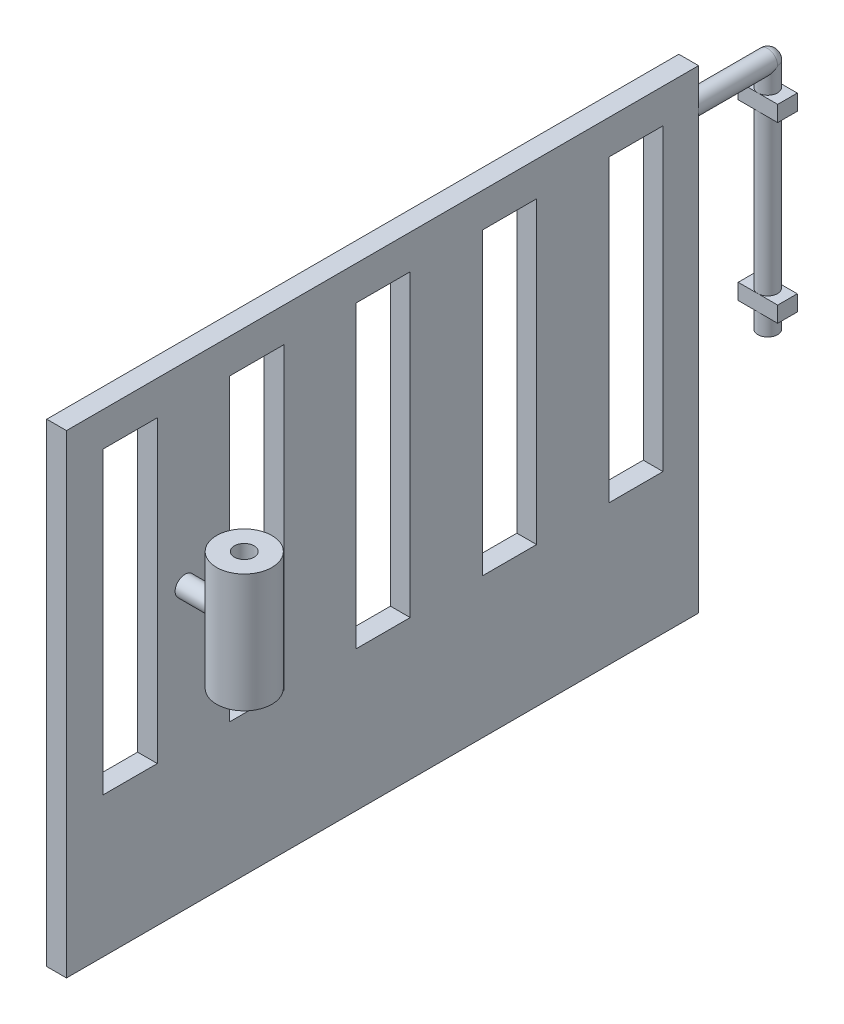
SolidWorks part; units mm, degrees
ref_plane "Face" through (0, 0, 0) normal (0, 0, 1) x (1, 0, 0)
ref_plane "Dessus" through (0, 0, 0) normal (0, 1, 0) x (1, 0, 0)
ref_plane "Droite" through (0, 0, 0) normal (1, 0, 0) x (0, 0, -1)
sketch "Esquisse1" plane through (0, 0, 0) normal (0, 0, 1) x (1, 0, 0)
  line L1 (0, 0) -> (5, 0)
  line L2 (0, 0) -> (0, 120)
  line L3 (0, 120) -> (5, 120)
  line L4 (5, 0) -> (5, 120)
  dimension "D1" = 5
  dimension "D2" = 120
extrude "Base-Extrusion" add sketch "Esquisse1" along normal blind 160
sketch "Esquisse2" plane through (0, 0, 0) normal (0, 0, -1) x (-1, 0, 0)
  line L0 (0, 120) -> (0, 0) construction
  circle A0 centre (-2.5, 110) radius 2.5
  dimension "D1" = 5
  dimension "D2" = 110
  dimension "D3" = 2.5
extrude "Boss.-Extru.1" add sketch "Esquisse2" along normal blind 20
sketch "Esquisse3" plane through (0, 0, -20) normal (0, 0, -1) x (-1, 0, 0)
  line L0 (-15.626, 110) -> (23.1147, 110) construction
  line L1 (-5, 110) -> (0, 110)
  circle A1 centre (-2.5, 110) radius 2.5
  arc A2 (0, 110) -> (-5, 110) centre (-2.5, 110) ccw
  dimension "D1" = 0
revolve "Boss.-Révol.1" add sketch "Esquisse3" angle 90 about L0
sketch "Esquisse4" plane through (0, 110, 0) normal (0, -1, 0) x (1, 0, 0)
  line L0 (2.5, -20) -> (2.5, 0) construction
  circle A0 centre (2.5, -20) radius 2.4792
extrude "Boss.-Extru.2" add sketch "Esquisse4" along normal blind 10
sketch "Esquisse5" plane through (0, 100, 0) normal (0, -1, 0) x (1, 0, 0)
  line L1 (7.5, -17.5208) -> (-2.5, -17.5208)
  line L2 (7.5, -17.5208) -> (7.5, -22.4792)
  line L3 (7.5, -22.4792) -> (-2.5, -22.4792)
  line L4 (-2.5, -17.5208) -> (-2.5, -22.4792)
  circle A0 centre (2.5, -20) radius 2.4792 construction
  dimension "D2" = 5
  dimension "D1" = 5
extrude "Boss.-Extru.3" add sketch "Esquisse5" against normal blind 4
sketch "Esquisse7" plane through (0, 100, 0) normal (0, -1, 0) x (1, 0, 0)
  arc A0 (2.5, -17.5208) -> (2.5, -22.4792) centre (2.5, -20) ccw construction
  arc A1 (2.5, -17.5208) -> (2.5, -22.4792) centre (2.5, -20) ccw
  arc A2 (2.5, -22.4792) -> (2.5, -17.5208) centre (2.5, -20) ccw construction
  arc A3 (2.5, -22.4792) -> (2.5, -17.5208) centre (2.5, -20) ccw
extrude "Boss.-Extru.4" add sketch "Esquisse7" along normal blind 40
sketch "Esquisse8" plane through (0, 60, 0) normal (0, -1, 0) x (1, 0, 0)
  line L1 (7.5, -17.5208) -> (-2.5, -17.5208)
  line L2 (7.5, -17.5208) -> (7.5, -22.4792)
  line L3 (7.5, -22.4792) -> (-2.5, -22.4792)
  line L4 (-2.5, -17.5208) -> (-2.5, -22.4792)
extrude "Boss.-Extru.5" add sketch "Esquisse8" along normal blind 4
sketch "Esquisse9" plane through (0, 56, 0) normal (0, -1, 0) x (1, 0, 0)
  arc A0 (2.5, -22.4792) -> (2.5, -17.5208) centre (2.5, -20) ccw construction
  arc A1 (2.5, -22.4792) -> (2.5, -17.5208) centre (2.5, -20) ccw
  arc A2 (2.5, -17.5208) -> (2.5, -22.4792) centre (2.5, -20) ccw construction
  arc A3 (2.5, -17.5208) -> (2.5, -22.4792) centre (2.5, -20) ccw
extrude "Boss.-Extru.6" add sketch "Esquisse9" along normal blind 5
sketch "Esquisse10" plane through (5, 0, 0) normal (1, 0, 0) x (0, 0, -1)
  line L0 (-160, 0) -> (-160, 120) construction
  line L1 (-160, 0) -> (0, 0) construction
  circle A0 centre (-130, 71) radius 2.5
  dimension "D1" = 5
  dimension "D2" = 30
  dimension "D3" = 71
extrude "Boss.-Extru.7" add sketch "Esquisse10" along normal blind 15
ref_plane "Plan1" through (0, 71, 0) normal (0, 1, 0) x (-1, 0, 0)
sketch "Esquisse11" plane through (0, 71, 0) normal (0, 1, 0) x (-1, 0, 0)
  line L0 (-20, 130) -> (-5, 130) construction
  line L1 (-20, 132.5) -> (-20, 127.5) construction
  circle A0 centre (-20, 130) radius 7
  dimension "D1" = 14
extrude "Boss.-Extru.8" add sketch "Esquisse11" along normal blind 15 and the other way blind 15
sketch "Esquisse12" plane through (0, 86, 0) normal (0, 1, 0) x (-1, 0, 0)
  circle A0 centre (-20, 130) radius 2.5
  dimension "D1" = 5
extrude "Enlèv. mat.-Extru.1" cut sketch "Esquisse12" against normal blind 44
sketch "Esquisse13" plane through (0, 0, 0) normal (-1, 0, 0) x (0, 0, 1)
  line L0 (41, 111.3184) -> (41, 35.5107)
  line L1 (9, 111.3184) -> (22.7265, 111.3184)
  line L2 (9, 111.3184) -> (9, 35.5107)
  line L3 (9, 35.5107) -> (22.7265, 35.5107)
  line L4 (22.7265, 111.3184) -> (22.7265, 35.5107)
  line L5 (41, 111.3184) -> (54.7265, 111.3184)
  line L6 (54.7265, 111.3184) -> (54.7265, 35.5107)
  line L7 (41, 35.5107) -> (54.7265, 35.5107)
  line L8 (73, 111.3184) -> (73, 35.5107)
  line L9 (73, 111.3184) -> (86.7265, 111.3184)
  line L10 (86.7265, 111.3184) -> (86.7265, 35.5107)
  line L11 (73, 35.5107) -> (86.7265, 35.5107)
  line L12 (105, 111.3184) -> (105, 35.5107)
  line L13 (105, 111.3184) -> (118.7265, 111.3184)
  line L14 (118.7265, 111.3184) -> (118.7265, 35.5107)
  line L15 (105, 35.5107) -> (118.7265, 35.5107)
  line L16 (137, 111.3184) -> (137, 35.5107)
  line L17 (137, 111.3184) -> (150.7265, 111.3184)
  line L18 (150.7265, 111.3184) -> (150.7265, 35.5107)
  line L19 (137, 35.5107) -> (150.7265, 35.5107)
  line L20 (0, 110) -> (0, 0) construction
  dimension "D1" = 9
extrude "Enlèv. mat.-Extru.2" cut sketch "Esquisse13" against normal blind 8
